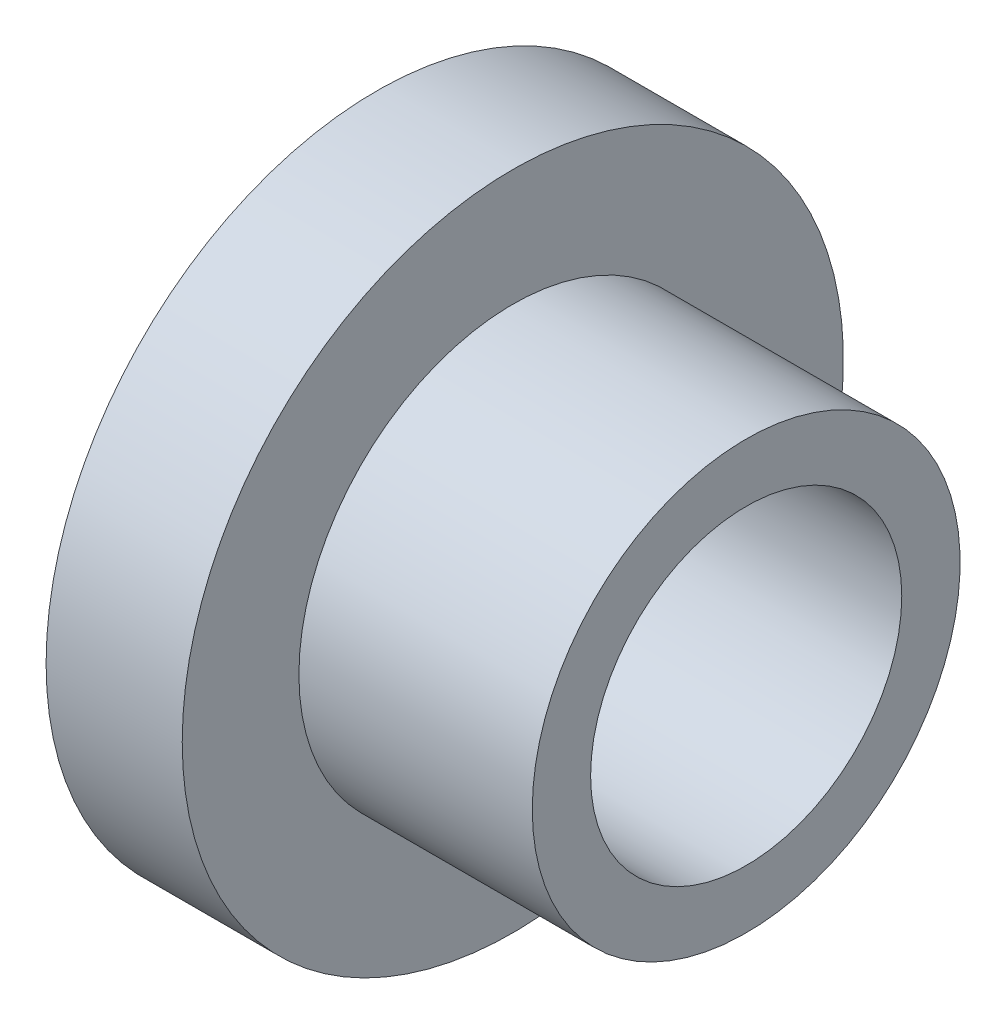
SolidWorks part; units mm, degrees
ref_plane "前基準面" through (0, 0, 0) normal (0, 0, 1) x (1, 0, 0)
ref_plane "上基準面" through (0, 0, 0) normal (0, 1, 0) x (1, 0, 0)
ref_plane "右基準面" through (0, 0, 0) normal (1, 0, 0) x (0, 0, -1)
sketch "草圖1" plane through (0, 0, 0) normal (0, 0, 1) x (1, 0, 0)
  line L0 (0, 0) -> (63.9373, 0) construction
  line L1 (0, 8) -> (0, 17)
  line L2 (0, 17) -> (7, 17)
  line L3 (7, 17) -> (7, 11)
  line L4 (7, 11) -> (19, 11)
  line L5 (19, 11) -> (19, 8)
  line L6 (19, 8) -> (0, 8)
  dimension "D1" = 16
  dimension "D2" = 22
  dimension "D3" = 34
  dimension "D4" = 7
  dimension "D5" = 19
revolve "旋轉1" add sketch "草圖1" angle 360 about L0
